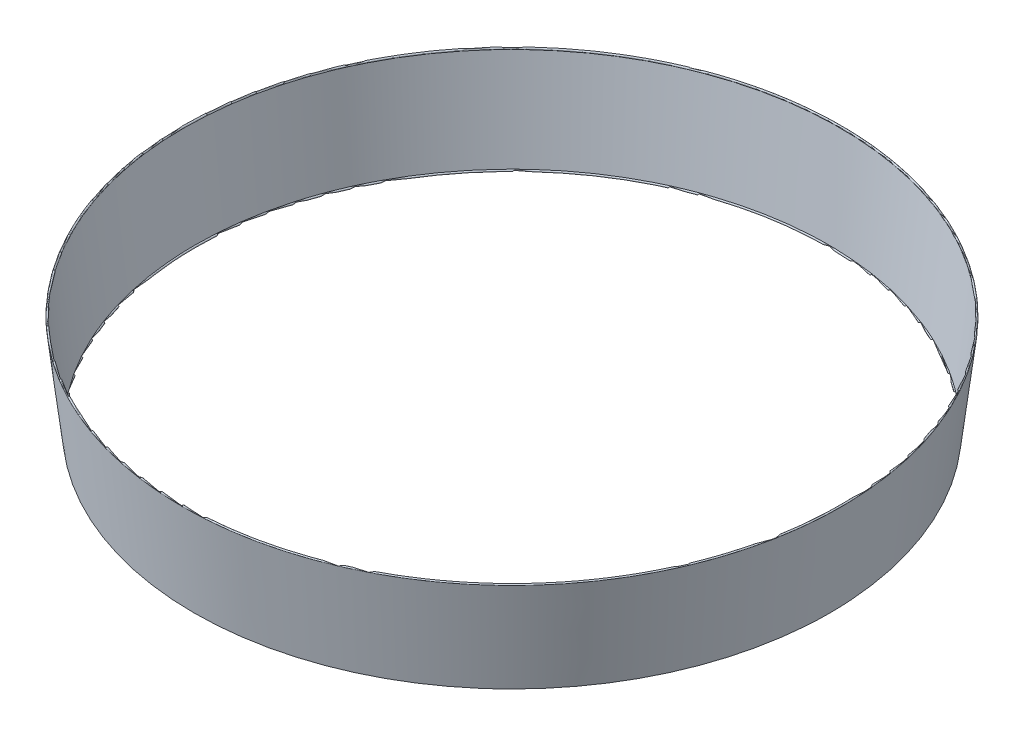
SolidWorks part; units mm, degrees
ref_plane "Alzado" through (0, 0, 0) normal (0, 0, 1) x (1, 0, 0)
ref_plane "Planta" through (0, 0, 0) normal (0, 1, 0) x (1, 0, 0)
ref_plane "Vista lateral" through (0, 0, 0) normal (1, 0, 0) x (0, 0, -1)
sketch "Croquis1" plane through (0, 0, 0) normal (0, 1, 0) x (1, 0, 0)
  circle A0 centre (0, 0) radius 260
  dimension "D1" = 520
ref_plane "Plano1" through (0, 80, 0) normal (0, 1, 0) x (1, 0, 0)
sketch "Croquis2" plane through (0, 80, 0) normal (0, 1, 0) x (1, 0, 0)
  circle A0 centre (0, 0) radius 269.5
  dimension "D1" = 539
sketch "Croquis3" plane through (0, 0, 0) normal (0, 0, 1) x (1, 0, 0)
  line L0 (-269.5, 80) -> (-260, 0)
loft "Recubrir1" add profiles "Croquis2", "Croquis1"
shell "Vaciado1" thickness 1
sketch "Croquis5" plane through (0, 1, 0) normal (0, 1, 0) x (1, 0, 0)
  spline S1 degree 3 number of poles 203 (259.1117, 0) -> (259.1117, 0)
  spline S2 degree 3 number of poles 203 (259.1117, 0) -> (259.1117, 0)
  dimension "D1" = 0
extrude "Cortar-Extruir1" cut sketch "Croquis5" against normal blind 10
sketch "Croquis6" plane through (0, 0, 0) normal (0, 0, 1) x (1, 0, 0)
  line L0 (0, 0) -> (0, 66.8545) construction
  circle A0 centre (268.7355, 80) radius 0.75
  circle A1 centre (258.946, 0.3721) radius 0.75
  dimension "D1" = 1.5
revolve "Revolución1" add sketch "Croquis6" angle 360 about L0
